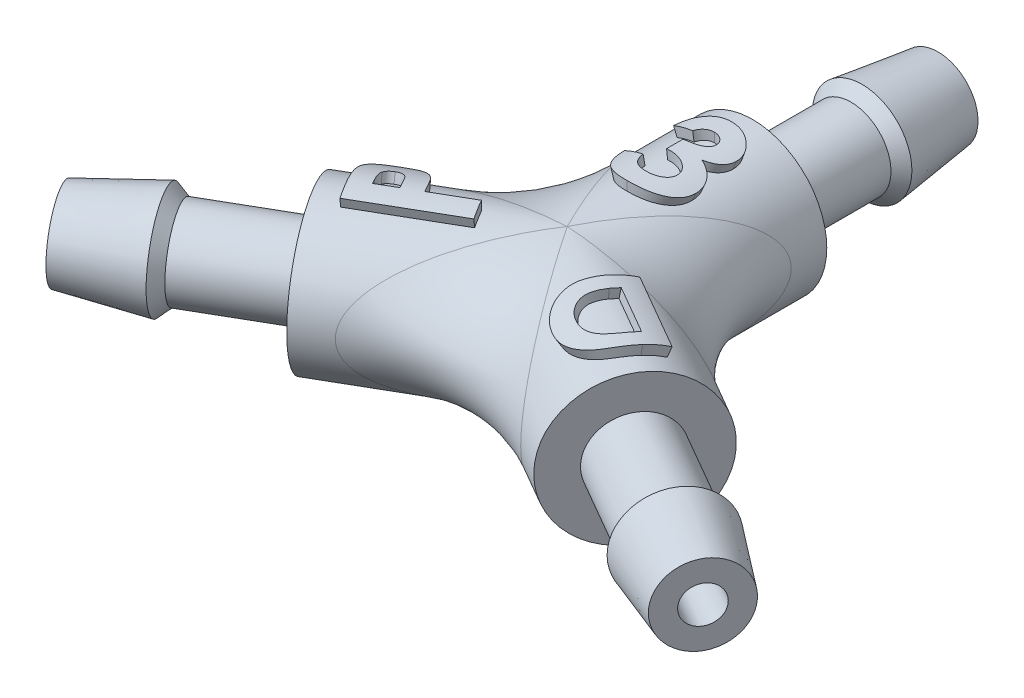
SolidWorks part; units mm, degrees
ref_plane "Front Plane" through (0, 0, 0) normal (0, 0, 1) x (1, 0, 0)
ref_plane "Top Plane" through (0, 0, 0) normal (0, 1, 0) x (1, 0, 0)
ref_plane "Right Plane" through (0, 0, 0) normal (1, 0, 0) x (0, 0, -1)
sketch "Sketch1" plane through (0, 0, 0) normal (0, 1, 0) x (1, 0, 0)
  line L0 (0, 0) -> (0, 43.6145)
  line L1 (0, 0) -> (-37.7713, -21.8072)
  line L2 (0, 0) -> (37.7713, -21.8072)
  line L3 (37.7713, -21.8072) -> (38.1685, -21.7917)
  dimension "D1" = 120
  dimension "D2" = 120
sketch "Sketch2" plane through (0, 0, 0) normal (0, 0, 1) x (1, 0, 0)
  circle A0 centre (0, 0) radius 4
  dimension "D1" = 8
extrude "Boss-Extrude1" add sketch "Sketch2" against normal blind 10
sketch "Sketch3" plane through (0, 0, 0) normal (0, 0, 1) x (1, 0, 0)
  line L0 (0, 21.8303) -> (0, -24.2097) construction
pattern_circular "CirPattern1" count 3 over 360 about axis through (0, 0, 0) along (0, 1, 0) of "Boss-Extrude1"
fillet "Fillet1" radius 10 3 edges at (-4, 0, -2.3094) (0, 0, 4.6188) (4, 0, -2.3094)
sketch "Sketch4" plane through (0, 0, -10) normal (0, 0, -1) x (-1, 0, 0)
  circle A0 centre (0, 0) radius 2.155
  dimension "D1" = 4.31
extrude "Boss-Extrude2" add sketch "Sketch4" along normal blind 10
pattern_circular "CirPattern2" count 3 over 360 about axis through (0, 0, 0) along (0, 1, 0) of "Boss-Extrude2"
sketch "Sketch5" plane through (0, 0, 0) normal (0, 1, 0) x (1, 0, 0)
  line L0 (0, 20) -> (0, 20.5125) construction
  line L1 (2.155, 20) -> (-2.155, 20) construction
  line L2 (0, 0) -> (0, 43.6145) construction
  line L3 (-2.155, 20) -> (-2.6862, 15.9043)
  line L4 (-2.6862, 15.9043) -> (-2.155, 15.3062)
  line L5 (-2.155, 20) -> (-2.155, 10) construction
  line L6 (-2.155, 15.3062) -> (-2.155, 20)
  dimension "D1" = 131
  dimension "D2" = 0.8
  dimension "D3" = 4.13
revolve "Revolve1" add sketch "Sketch5" angle 360 about L0
pattern_circular "CirPattern3" count 3 over 360 about axis through (0, 21.8303, 0) along (0, -1, 0) of "Revolve1"
sketch "Sketch6" plane through (17.3205, 0, 10) normal (0.866, 0, 0.5) x (0.5, 0, -0.866)
  circle A0 centre (0, 0) radius 1
  dimension "D1" = 2
extrude "Cut-Extrude1" cut sketch "Sketch6" against normal blind 20
pattern_circular "CirPattern4" count 3 over 360 about axis through (0, 21.8303, 0) along (0, -1, 0) of "Cut-Extrude1"
fillet "Fillet4" radius 5 3 edges at (1, 0, -0.5774) (-1, 0, -0.5774) (0, 0, 1.1547)
ref_plane "Plane1" through (0, 10, 0) normal (0, 1, 0) x (1, 0, 0)
sketch "Sketch8" plane through (0, 10, 0) normal (0, 1, 0) x (1, 0, 0)
  text T0 "<b>3</b>" font "Century Gothic" height in points 20
wrap "Wrap1" sketch "Sketch8" wrap type emboss source sketch "Sketch8" thickness 0.5 parameters "D1"=0.5
sketch "Sketch9" plane through (0, 10, 0) normal (0, 1, 0) x (1, 0, 0)
  text T0 "<b><r240>D</r></b>" font "Century Gothic" height in points 18
wrap "Wrap2" sketch "Sketch9" wrap type emboss source sketch "Sketch9" thickness 0.5 parameters "D1"=0.5
sketch "Sketch10" plane through (0, 10, 0) normal (0, 1, 0) x (1, 0, 0)
  text T0 "<b><r120>P</r></b>" font "Century Gothic" height in points 20
wrap "Wrap3" sketch "Sketch10" wrap type emboss source sketch "Sketch10" thickness 0.5 parameters "D1"=0.5
